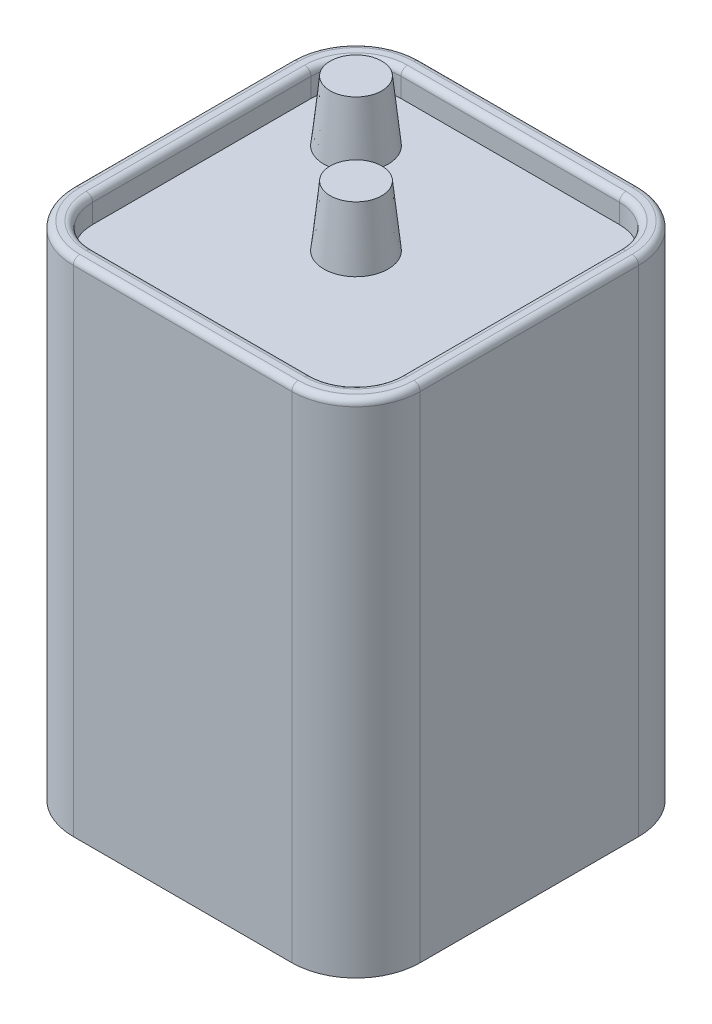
SolidWorks part; units mm, degrees
ref_plane "Front Plane" through (0, 0, 0) normal (0, 0, 1) x (1, 0, 0)
ref_plane "Top Plane" through (0, 0, 0) normal (0, 1, 0) x (1, 0, 0)
ref_plane "Right Plane" through (0, 0, 0) normal (1, 0, 0) x (0, 0, -1)
sketch "Sketch3" plane through (0, 0, 0) normal (0, 1, 0) x (1, 0, 0)
  line L1 (-34.29, -34.29) -> (34.29, -34.29)
  line L2 (-34.29, -34.29) -> (-34.29, 34.29)
  line L3 (-34.29, 34.29) -> (34.29, 34.29)
  line L4 (34.29, -34.29) -> (34.29, 34.29)
  line L5 (-34.29, -34.29) -> (34.29, 34.29) construction
  line L6 (-34.29, 34.29) -> (34.29, -34.29) construction
  point P0 (0, 0)
  dimension "D1" = 68.58
  dimension "D2" = 68.58
extrude "Base Extrude" add sketch "Sketch3" along normal blind 99.06
fillet "Side Fillets" radius 12.7 4 edges at (-34.29, 49.53, -34.29) (34.29, 49.53, 34.29) (34.29, 49.53, -34.29) (-34.29, 49.53, 34.29)
sketch "Sketch4" plane through (0, 99.06, 0) normal (0, 1, 0) x (1, 0, 0)
  line L8 (21.59, 30.48) -> (-21.59, 30.48)
  line L9 (-30.48, 21.59) -> (-30.48, -21.59)
  line L10 (-21.59, -30.48) -> (21.59, -30.48)
  line L11 (30.48, -21.59) -> (30.48, 21.59)
  line L12 (21.59, 30.48) -> (-21.59, 30.48)
  line L13 (-30.48, 21.59) -> (-30.48, -21.59)
  line L14 (-21.59, -30.48) -> (21.59, -30.48)
  line L15 (30.48, -21.59) -> (30.48, 21.59)
  arc A8 (-21.59, 30.48) -> (-30.48, 21.59) centre (-21.59, 21.59) ccw
  arc A9 (-30.48, -21.59) -> (-21.59, -30.48) centre (-21.59, -21.59) ccw
  arc A10 (21.59, -30.48) -> (30.48, -21.59) centre (21.59, -21.59) ccw
  arc A11 (30.48, 21.59) -> (21.59, 30.48) centre (21.59, 21.59) ccw
  arc A12 (-21.59, 30.48) -> (-30.48, 21.59) centre (-21.59, 21.59) ccw
  arc A13 (-30.48, -21.59) -> (-21.59, -30.48) centre (-21.59, -21.59) ccw
  arc A14 (21.59, -30.48) -> (30.48, -21.59) centre (21.59, -21.59) ccw
  arc A15 (30.48, 21.59) -> (21.59, 30.48) centre (21.59, 21.59) ccw
  dimension "D1" = 3.81
extrude "Top Cut" cut sketch "Sketch4" against normal blind 5.08
fillet "Top Face Fillet" radius 1.27 16 edges at (30.5703, 99.06, -30.5703) (34.29, 99.06, 0) (30.5703, 99.06, 30.5703) (0, 99.06, 34.29) (-30.5703, 99.06, 30.5703) (-34.29, 99.06, 0) (-30.5703, 99.06, -30.5703) (0, 99.06, -34.29) (-27.8762, 99.06, -27.8762) (-30.48, 99.06, 0) (-27.8762, 99.06, 27.8762) (0, 99.06, 30.48) (27.8762, 99.06, 27.8762) (30.48, 99.06, 0) (27.8762, 99.06, -27.8762) (0, 99.06, -30.48)
sketch "Sketch-Terminals" plane through (0, 93.98, 0) normal (0, 1, 0) x (1, 0, 0)
  line L1 (-17.9605, 17.9605) -> (0, 0) construction
  line L2 (0, -55) -> (0, 55) construction
  circle A0 centre (0, 0) radius 6.35
  circle A1 centre (-17.9605, 17.9605) radius 6.35
  dimension "D1" = 12.7
  dimension "D2" = 12.7
  dimension "D3" = 25.4
  dimension "D4" = 45
extrude "Terminals" add sketch "Sketch-Terminals" along normal blind 11.938 draft 6
